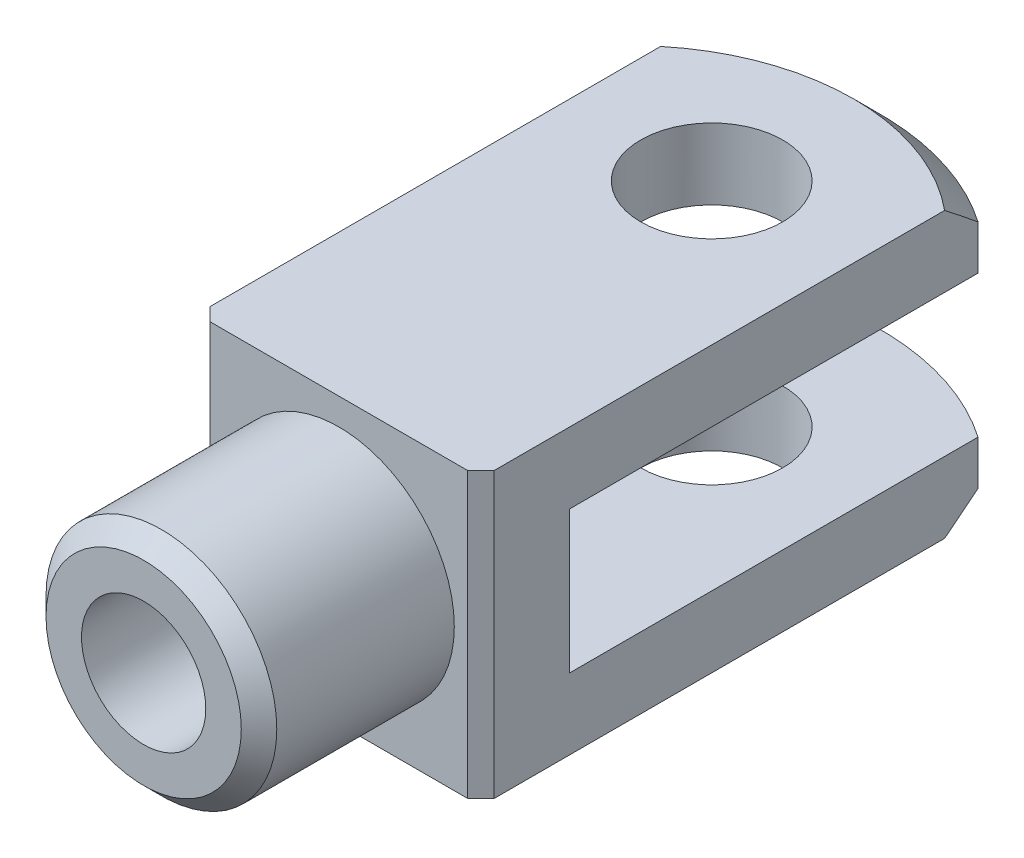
SolidWorks part; units mm, degrees
ref_plane "Face" through (0, 0, 0) normal (0, 0, 1) x (1, 0, 0)
ref_plane "Dessus" through (0, 0, 0) normal (0, 1, 0) x (1, 0, 0)
ref_plane "Droite" through (0, 0, 0) normal (1, 0, 0) x (0, 0, -1)
sketch "Esquisse1" plane through (0, 0, 0) normal (0, 0, 1) x (1, 0, 0)
  line L1 (-16, 16) -> (16, 16)
  line L2 (-16, 16) -> (-16, -16)
  line L3 (-16, -16) -> (16, -16)
  line L4 (16, 16) -> (16, -16)
  dimension "D1" = 32
  dimension "D2" = 32
  dimension "D3" = 16
  dimension "D4" = 16
extrude "Base-Extrusion" add sketch "Esquisse1" along normal blind 83
sketch "Esquisse2" plane through (16, 0, 0) normal (1, 0, 0) x (0, 0, -1)
  line L0 (0, -16) -> (0, 16) construction
  line L1 (-51, -8) -> (0, -8)
  line L2 (-51, -8) -> (-51, 8)
  line L3 (-51, 8) -> (0, 8)
  line L4 (0, -8) -> (0, 8)
  line L5 (-83, 16) -> (0, 16) construction
  dimension "D1" = 51
  dimension "D2" = 16
  dimension "D3" = 8
extrude "Enlèv. mat.-Extru.1" cut sketch "Esquisse2" against normal blind 54
sketch "Esquisse3" plane through (0, 0, 83) normal (0, 0, 1) x (1, 0, 0)
  circle A0 centre (0, 0) radius 13
  dimension "D1" = 26
extrude "Enlèv. mat.-Extru.3" cut sketch "Esquisse3" against normal blind 22 flip side to cut
sketch "Esquisse4" plane through (0, 16, 0) normal (0, 1, 0) x (-1, 0, 0)
  line L0 (0, 61) -> (0, 83) construction
  line L1 (-16, 0) -> (16, 0) construction
  circle A0 centre (0, 19) radius 8
  dimension "D1" = 16
  dimension "D2" = 19
extrude "Enlèv. mat.-Extru.4" cut sketch "Esquisse4" against normal blind 50
chamfer "Chanfrein2" distance 2 angle 45
hole_wizard "Trou taraudé M16x2.01" positions "Esquisse7" profile "Esquisse6" tap size "M16x2.0" standard "ISO"
sketch "Esquisse7" plane through (0, 0, 83) normal (0, 0, 1) x (1, 0, 0)
  point P0 (0, 0)
sketch "Esquisse6" plane through (0, 0, 83) normal (1, 0, 0) x (0, -1, 0)
  line L0 (0, 0) -> (0, 56.206)
  line L1 (0, 56.206) -> (7, 52)
  line L2 (7, 52) -> (7, 0)
  line L5 (7, 0) -> (0, 0)
  line L10 (0, 56.206) -> (-7, 52) construction
  line L11 (0, -6.35) -> (0, 107.95) construction
  dimension "Diamètre du perçage" = 14
  dimension "Profondeur du perçage" = 52
  dimension "Angle de pointe" = 118
sketch "Esquisse9" plane through (0, 16, 0) normal (0, 1, 0) x (-1, 0, 0)
  line L0 (16, 61) -> (16, 0) construction
  line L1 (-16, 61) -> (-16, 0) construction
  line L2 (-16, 0) -> (16, 0) construction
  arc A0 (16, 5) -> (-16, 5) centre (0, 28.1) cw
  dimension "D1" = 5
  dimension "D2" = 5
extrude "Enlèv. mat.-Extru.8" cut sketch "Esquisse9" against normal through all and the other way through all
chamfer "Chanfrein3" distance 3 angle 45
chamfer "Chanfrein4" distance 1.5 angle 45
